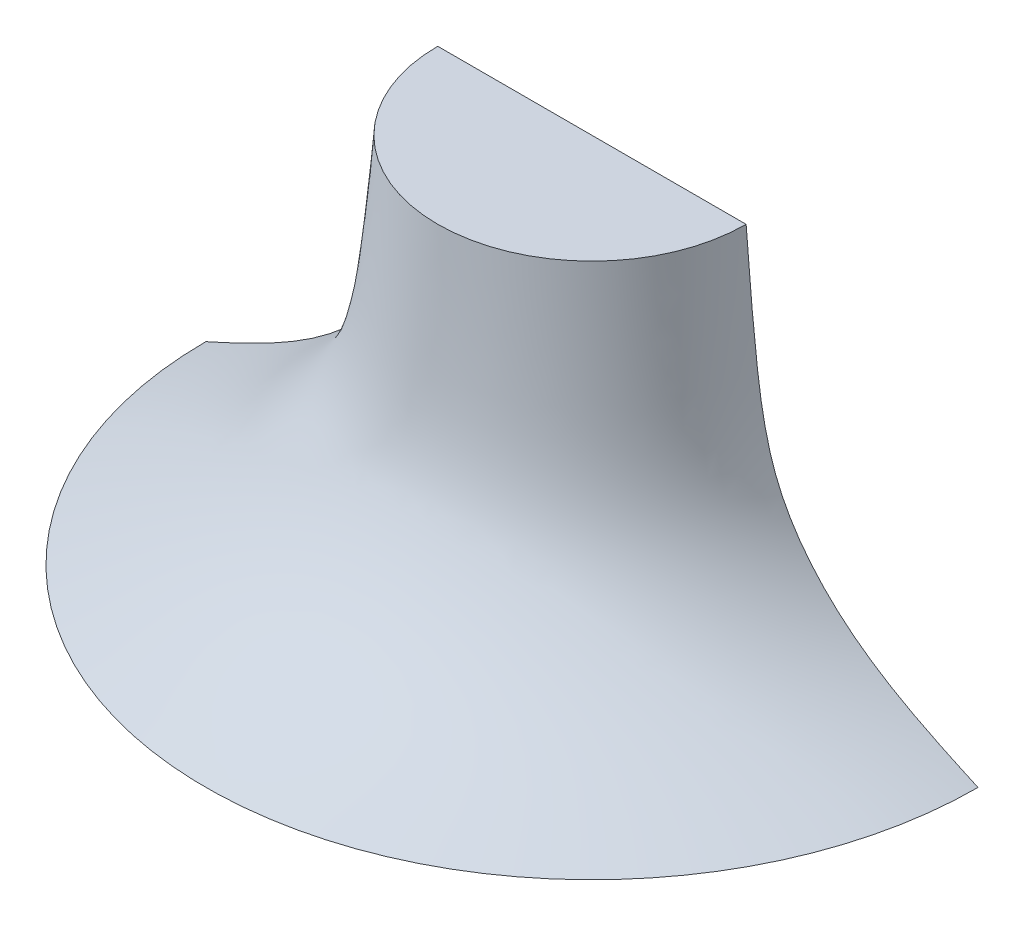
SolidWorks part; units mm, degrees
ref_plane "Front Plane" through (0, 0, 0) normal (0, 0, 1) x (1, 0, 0)
ref_plane "Top Plane" through (0, 0, 0) normal (0, 1, 0) x (1, 0, 0)
ref_plane "Right Plane" through (0, 0, 0) normal (1, 0, 0) x (0, 0, -1)
sketch "Sketch1" plane through (0, 0, 0) normal (0, 0, 1) x (1, 0, 0)
  line L0 (29.912, -43.487) -> (29.912, 51.513) construction
  line L1 (29.912, 48.513) -> (-6.7197, 48.513)
  line L2 (29.912, 51.513) -> (-9.4909, 51.513)
  line L3 (29.912, -43.487) -> (-68.7472, -43.487)
  line L4 (29.912, -40.487) -> (-55.2922, -40.487)
  line L5 (29.912, -43.487) -> (29.912, -40.487)
  line L6 (29.912, 51.513) -> (29.912, 48.513)
  spline S0 degree 3 poles (-68.7472, -43.487) (-67.2694, -42.8166) (-55.7295, -37.5668) (-36.1235, -27.7118) (-15.8763, -4.2793) (-12.1084, 21.4292) (-10.4181, 39.8855) (-9.686, 49.0407) (-9.4909, 51.513) knots 0.066076 0.066076 0.066076 0.066076 0.101283 0.340833 0.539778 0.744207 0.890468 0.944398 0.944398 0.944398 0.944398
  spline S1 degree 3 poles (-6.7197, 48.513) (-7.0689, 44.1471) (-7.7979, 35.4317) (-9.1268, 22.2951) (-10.679, 11.0452) (-12.9544, 2.1913) (-15.3691, -4.2892) (-18.6767, -10.4367) (-24.0494, -18.0142) (-32.2516, -26.349) (-43.4132, -34.2635) (-51.2805, -38.4923) (-55.2922, -40.487) knots 0.162762 0.162762 0.162762 0.162762 0.257955 0.353148 0.448341 0.495938 0.543534 0.591131 0.638727 0.73392 0.829114 0.924307 0.924307 0.924307 0.924307
revolve "Revolve1" add sketch "Sketch1" angle 180 about L0
